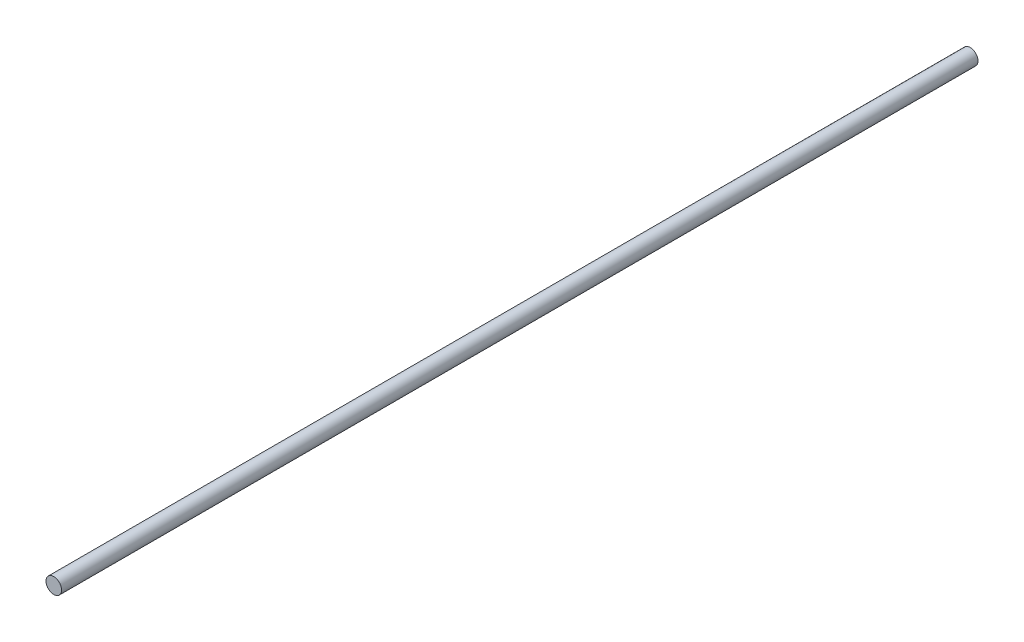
SolidWorks part; units mm, degrees
ref_plane "Front Plane" through (0, 0, 0) normal (0, 0, 1) x (1, 0, 0)
ref_plane "Top Plane" through (0, 0, 0) normal (0, 1, 0) x (1, 0, 0)
ref_plane "Right Plane" through (0, 0, 0) normal (1, 0, 0) x (0, 0, -1)
sketch "Sketch1" plane through (0, 0, 0) normal (0, 0, 1) x (1, 0, 0)
  circle A0 centre (0, 0) radius 8.5
  dimension "D1" = 17
extrude "Boss-Extrude1" add sketch "Sketch1" along normal blind 1000
